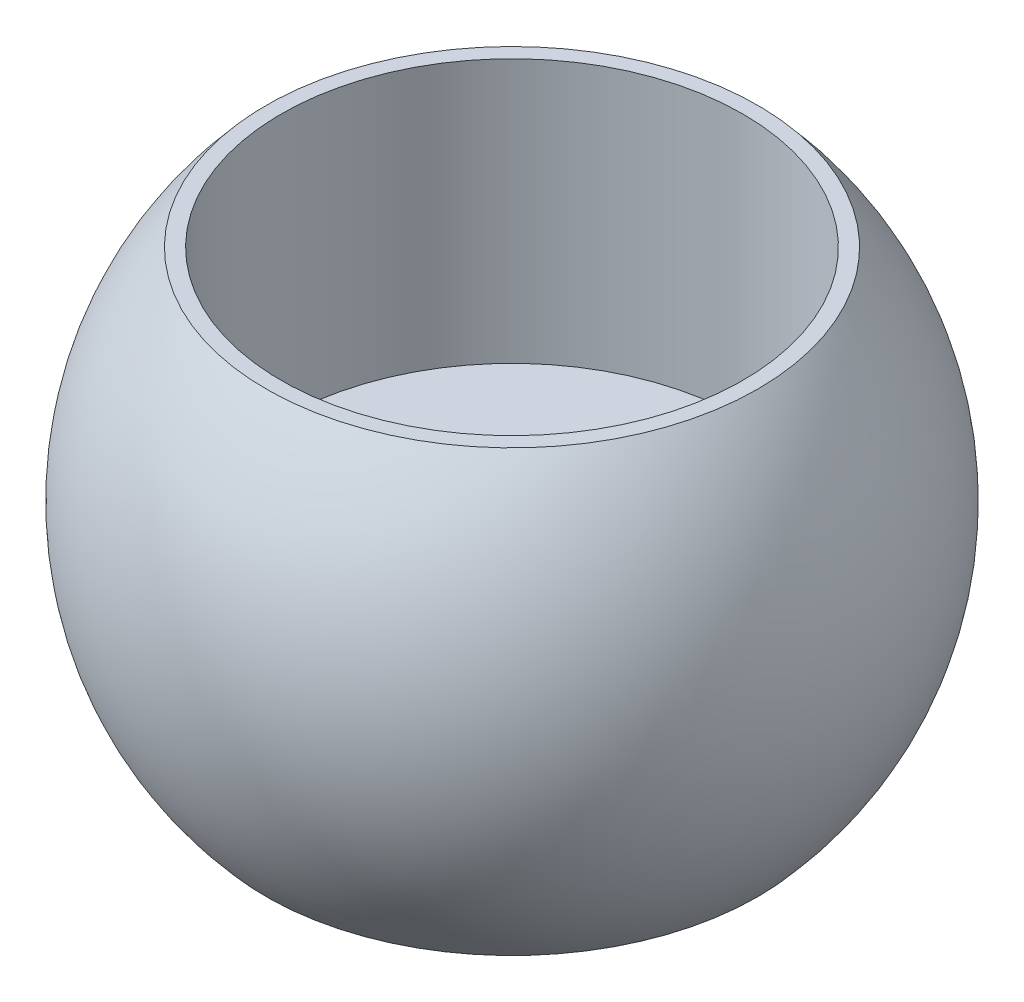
SolidWorks part; units mm, degrees
ref_plane "Anteriore" through (0, 0, 0) normal (0, 0, 1) x (1, 0, 0)
ref_plane "Superiore" through (0, 0, 0) normal (0, 1, 0) x (1, 0, 0)
ref_plane "Destro" through (0, 0, 0) normal (1, 0, 0) x (0, 0, -1)
sketch "Schizzo1" plane through (0, 0, 0) normal (0, 0, 1) x (1, 0, 0)
  line L0 (0, -86) -> (0, 86) construction
  line L1 (5.5, -2) -> (5.5, -5)
  line L2 (10.5, 10) -> (11.1803, 10)
  line L3 (11, -10) -> (11.1803, -10)
  line L4 (0, 0) -> (15, 0) construction
  line L6 (11, -10) -> (5.5, -5)
  line L7 (5.5, -2) -> (10.5, -2)
  line L8 (10.5, -2) -> (10.5, 10)
  arc A0 (11.1803, -10) -> (11.1803, 10) centre (0, 0) ccw
  dimension "D1" = 30
  dimension "D2" = 20
  dimension "D3" = 5.5
  dimension "D4" = 11
  dimension "D5" = 3
  dimension "D6" = 8
  dimension "D8" = 10.5
revolve "Rivoluzione1" add sketch "Schizzo1" angle 360 about L0
